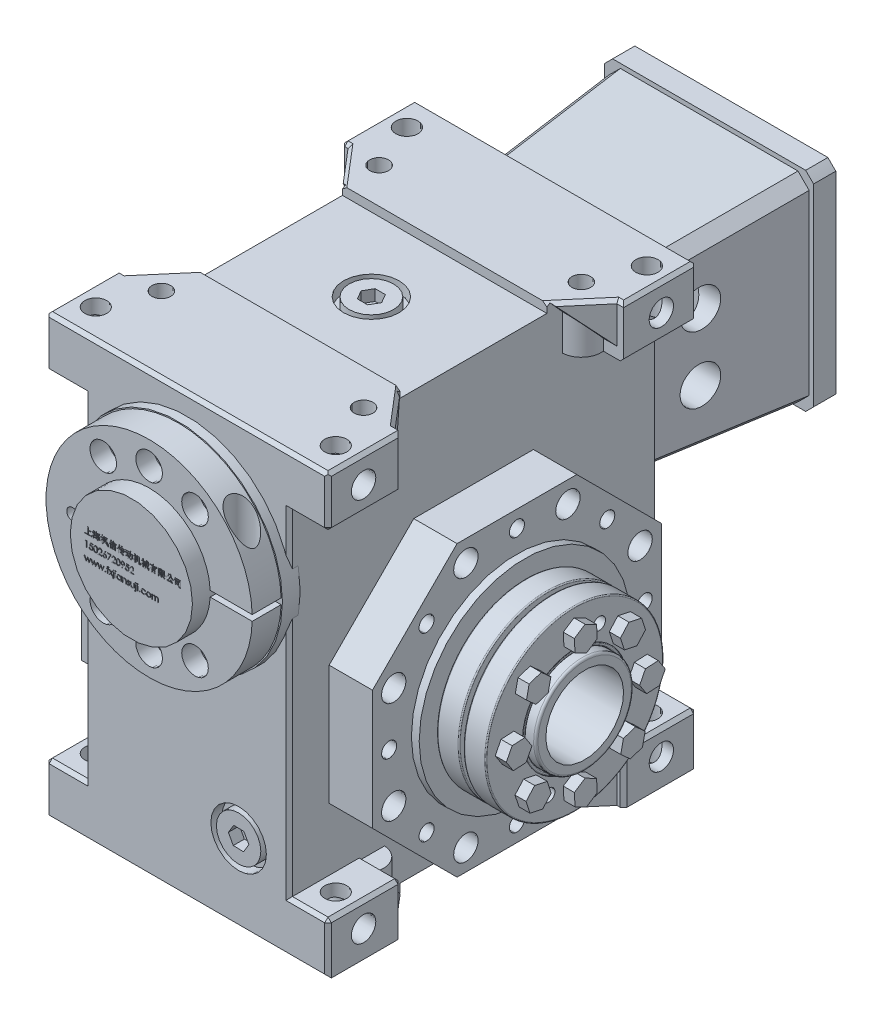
SolidWorks part; units mm, degrees
ref_plane "前视基准面" through (0, 0, 0) normal (0, 0, 1) x (1, 0, 0)
ref_plane "上视基准面" through (0, 0, 0) normal (0, 1, 0) x (1, 0, 0)
ref_plane "右视基准面" through (0, 0, 0) normal (1, 0, 0) x (0, 0, -1)
imported_body "JDLB063-CR箱体-1-solid1"
imported_body "JDLB063-CR箱体-1-solid2"
imported_body "JDLB063-2C空心轴Φ35-1-solid1"
imported_body "JDLB063-ST94输入法兰-1-solid1"
imported_body "JDLB063-C1锁紧盘-44-80-25-1-solid1"
imported_body "JDLB063-C1锁紧盘-44-80-25-1-solid2"
imported_body "JDLB063-C1锁紧盘-44-80-25-1-solid3"
imported_body "JDLB063-C1锁紧盘-44-80-25-2-solid1"
imported_body "JDLB063-C1锁紧盘-44-80-25-2-solid2"
imported_body "JDLB063-C1锁紧盘-44-80-25-2-solid3"
imported_body "联轴器BD56-60-20-19锁紧-1-solid1"
imported_body "联轴器BD56-60-20-19锁紧-1-solid2"
imported_body "联轴器BD56-60-20-19锁紧-1-solid3"
imported_body "联轴器BD56-60-20-19锁紧-1-solid4"
imported_body "联轴器BD56-60-20-19锁紧-1-solid5"
imported_body "联轴器BD56-60-20-19锁紧-1-solid6"
imported_body "联轴器BD56-60-20-19锁紧-1-solid7"
imported_body "联轴器BD56-60-20-19锁紧-1-solid8"
imported_body "联轴器BD56-60-20-19锁紧-1-solid9"
imported_body "联轴器BD56-60-20-19锁紧-1-solid10"
imported_body "联轴器BD56-60-20-19锁紧-1-solid11"
sketch "草图1" plane through (47, 0, 0) normal (1, 0, 0) x (0, 0, -1)
  line L1 (-28.2347, 101.6755) -> (31.507, 101.6755)
  line L2 (-28.2347, 101.6755) -> (-28.2347, 87.3711)
  line L3 (-28.2347, 87.3711) -> (31.507, 87.3711)
  line L4 (31.507, 101.6755) -> (31.507, 87.3711)
extrude "切除-拉伸1" cut sketch "草图1" against normal up to surface (1 mm away)
sketch "草图2" plane through (-47, 0, 0) normal (-1, 0, 0) x (0, 0, 1)
  line L1 (-28.6187, 100.5542) -> (27.3015, 100.5542)
  line L2 (-28.6187, 100.5542) -> (-28.6187, 87.6043)
  line L3 (-28.6187, 87.6043) -> (27.3015, 87.6043)
  line L4 (27.3015, 100.5542) -> (27.3015, 87.6043)
extrude "切除-拉伸2" cut sketch "草图2" against normal up to surface (1 mm away)
sketch "草图3" plane through (0, 0, 108) normal (0, 0, 1) x (1, 0, 0)
  text T0 "上海枫信传动机械有限公司  15026720952  www.fxjiansuji.com" font "Century Gothic" height in points 10
extrude "凸台-拉伸1" add sketch "草图3" along normal blind 0.2
